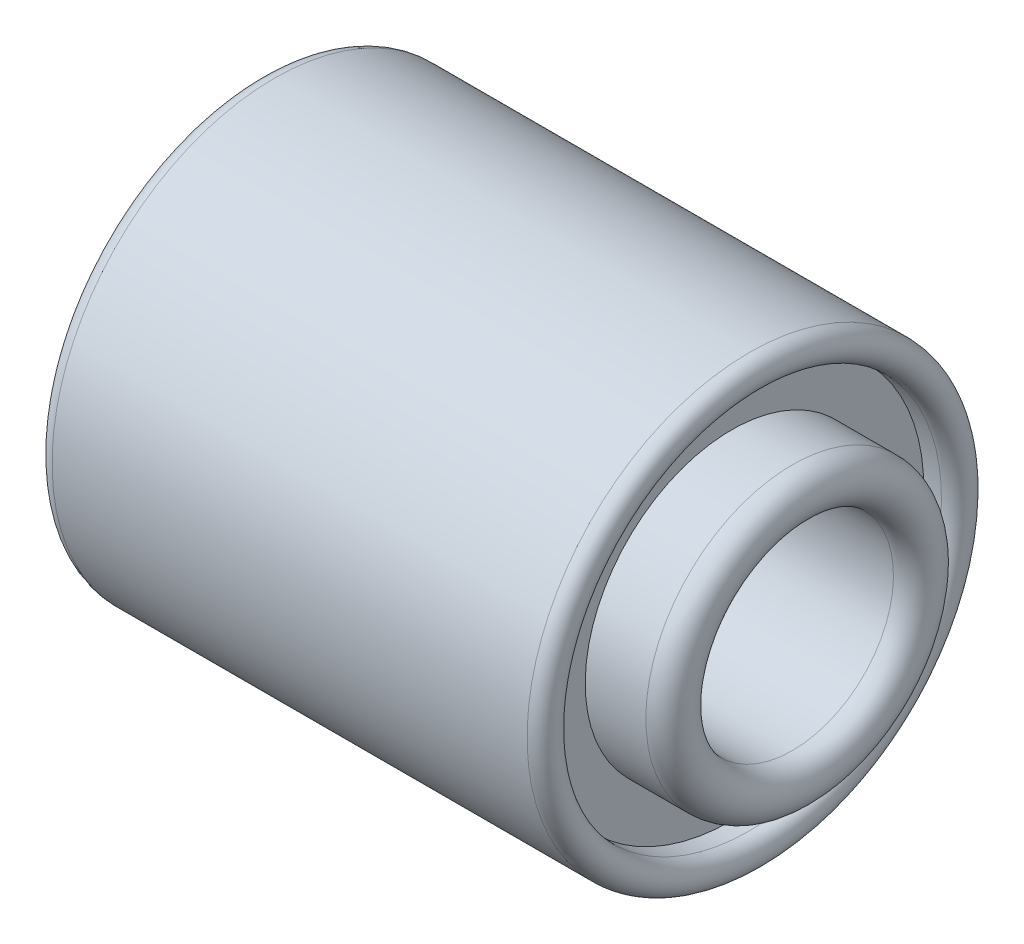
SolidWorks part; units mm, degrees
ref_plane "Plan1" through (0, 0, 0) normal (0, 0, 1) x (1, 0, 0)
ref_plane "Plan2" through (0, 0, 0) normal (0, 1, 0) x (1, 0, 0)
ref_plane "Plan3" through (0, 0, 0) normal (1, 0, 0) x (0, 0, -1)
sketch "Esquisse1" plane through (0, 0, 0) normal (0, 0, 1) x (1, 0, 0)
  line L0 (-35.5306, 0) -> (35.5306, 0) construction
  line L1 (-13.875, 5) -> (13.875, 5)
  line L2 (-10.875, 7.25) -> (-13.875, 7.25)
  line L3 (-10.875, 7.25) -> (-10.875, 9.5)
  line L4 (-10.875, 9.5) -> (-11.75, 9.5)
  line L5 (-11.75, 11) -> (11.75, 11)
  line L6 (11.75, 9.5) -> (10.875, 9.5)
  line L7 (10.875, 7.25) -> (13.875, 7.25)
  line L8 (10.875, 7.25) -> (10.875, 9.5)
  arc A0 (11.75, 11) -> (11.75, 9.5) centre (11.75, 10.25) cw
  arc A1 (13.875, 7.25) -> (13.875, 5) centre (13.875, 6.125) cw
  arc A2 (-13.875, 7.25) -> (-13.875, 5) centre (-13.875, 6.125) ccw
  arc A3 (-11.75, 9.5) -> (-11.75, 11) centre (-11.75, 10.25) cw
  dimension "D5" = 3
  dimension "D6" = 30
  dimension "D7" = 25
  dimension "D8" = 15
  dimension "D1" = 10
  dimension "D2" = 14.5
  dimension "D3" = 19
  dimension "D4" = 22
  dimension "D9" = 12.5
revolve "Base-Révolution" add sketch "Esquisse1" angle 360 about L0
